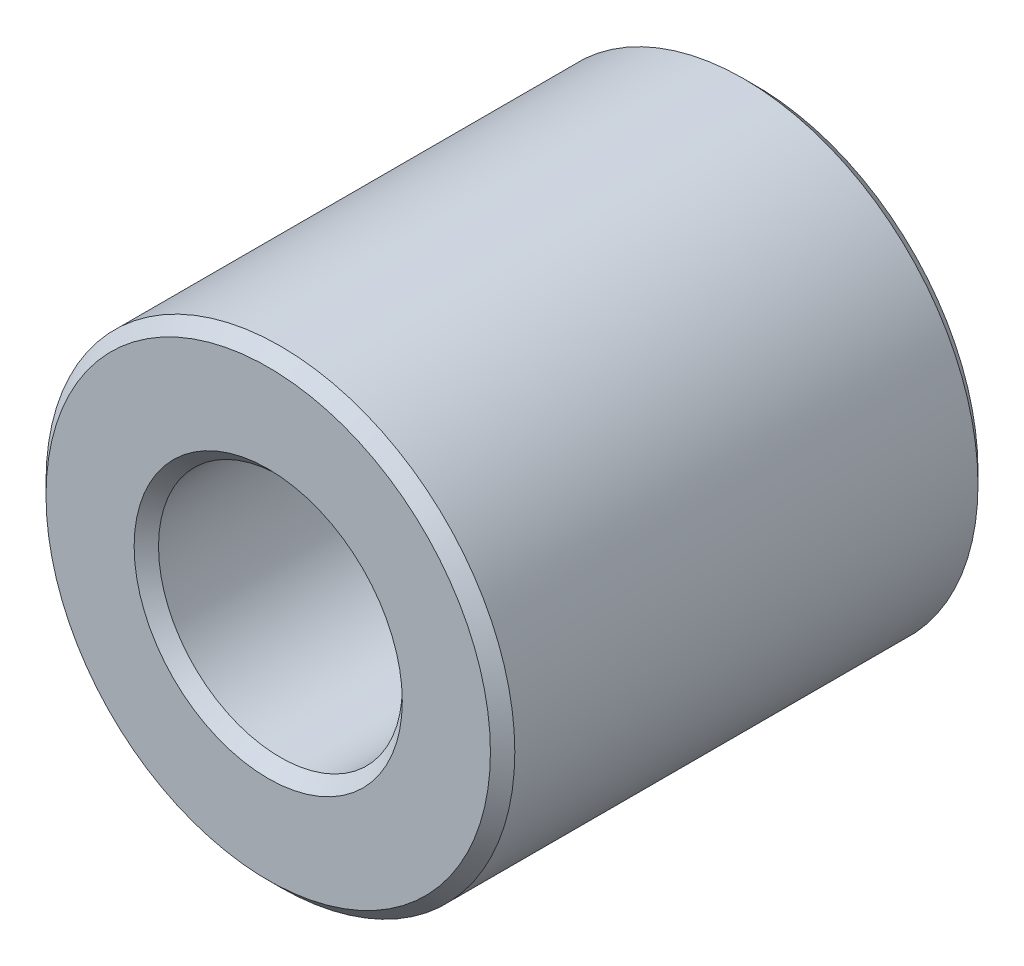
SolidWorks part; units mm, degrees
ref_plane "Front Plane" through (0, 0, 0) normal (0, 0, 1) x (1, 0, 0)
ref_plane "Top Plane" through (0, 0, 0) normal (0, 1, 0) x (1, 0, 0)
ref_plane "Right Plane" through (0, 0, 0) normal (1, 0, 0) x (0, 0, -1)
sketch "Sketch1" plane through (0, 0, 0) normal (0, 0, 1) x (1, 0, 0)
  circle A0 centre (0, 0) radius 13
  circle A1 centre (0, 0) radius 25
  dimension "D1" = 26
  dimension "D2" = 50
extrude "Boss-Extrude1" add sketch "Sketch1" along normal mid plane 52
chamfer "Chamfer1" distance 1.3 angle 45 4 edges at (13, 0, -26) (25, 0, -26) (13, 0, 26) (25, 0, 26)
